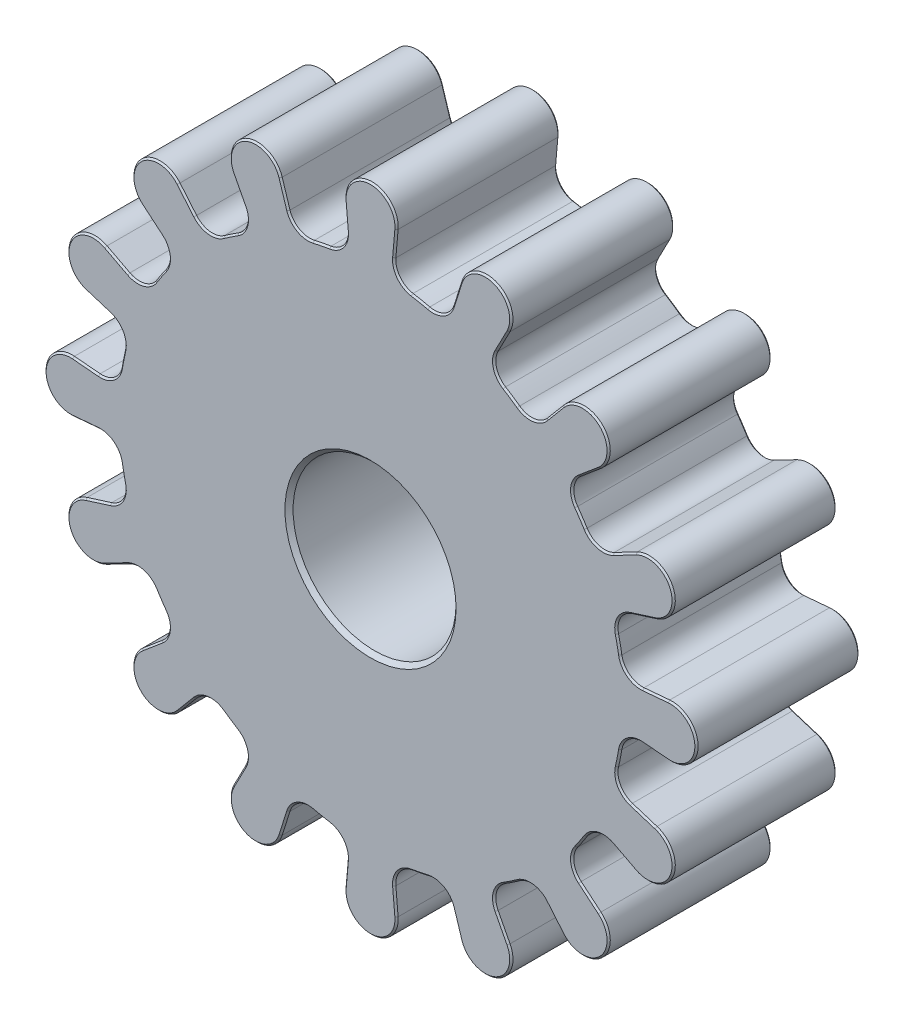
SolidWorks part; units mm, degrees
ref_plane "Спереди" through (0, 0, 0) normal (0, 0, 1) x (1, 0, 0)
ref_plane "Сверху" through (0, 0, 0) normal (0, 1, 0) x (1, 0, 0)
ref_plane "Справа" through (0, 0, 0) normal (1, 0, 0) x (0, 0, -1)
sketch "Эскиз1" plane through (0, 0, 0) normal (0, 0, 1) x (1, 0, 0)
  line L0 (-1.4563, 16.6835) -> (-1.5939, 18.2609)
  line L1 (1.4563, 16.6835) -> (1.5939, 18.2609)
  line L2 (5.0391, 15.9708) -> (5.5155, 17.4808)
  line L3 (7.7299, 14.8562) -> (8.4607, 16.2609)
  line L4 (10.7673, 12.8267) -> (11.7853, 14.0395)
  line L5 (12.8267, 10.7673) -> (14.0395, 11.7853)
  line L6 (14.8562, 7.7299) -> (16.2609, 8.4607)
  line L7 (15.9708, 5.0391) -> (17.4808, 5.5155)
  line L8 (16.6835, 1.4563) -> (18.2609, 1.5939)
  line L9 (16.6835, -1.4563) -> (18.2609, -1.5939)
  line L10 (15.9708, -5.0391) -> (17.4808, -5.5155)
  line L11 (14.8562, -7.7299) -> (16.2609, -8.4607)
  line L12 (12.8267, -10.7673) -> (14.0395, -11.7853)
  line L13 (10.7673, -12.8267) -> (11.7853, -14.0395)
  line L14 (7.7299, -14.8562) -> (8.4607, -16.2609)
  line L15 (5.0391, -15.9708) -> (5.5155, -17.4808)
  line L16 (1.4563, -16.6835) -> (1.5939, -18.2609)
  line L17 (-1.4563, -16.6835) -> (-1.5939, -18.2609)
  line L18 (-5.0391, -15.9708) -> (-5.5155, -17.4808)
  line L19 (-7.7299, -14.8562) -> (-8.4607, -16.2609)
  line L20 (-10.7673, -12.8267) -> (-11.7853, -14.0395)
  line L21 (-12.8267, -10.7673) -> (-14.0395, -11.7853)
  line L22 (-14.8562, -7.7299) -> (-16.2609, -8.4607)
  line L23 (-15.9708, -5.0391) -> (-17.4808, -5.5155)
  line L24 (-16.6835, -1.4563) -> (-18.2609, -1.5939)
  line L25 (-16.6835, 1.4563) -> (-18.2609, 1.5939)
  line L26 (-15.9708, 5.0391) -> (-17.4808, 5.5155)
  line L27 (-14.8562, 7.7299) -> (-16.2609, 8.4607)
  line L28 (-12.8267, 10.7673) -> (-14.0395, 11.7853)
  line L29 (-10.7673, 12.8267) -> (-11.7853, 14.0395)
  line L30 (-7.7299, 14.8562) -> (-8.4607, 16.2609)
  line L31 (-5.0391, 15.9708) -> (-5.5155, 17.4808)
  circle A0 centre (0, 0) radius 18.4 construction
  arc A1 (1.5939, 18.2609) -> (-1.5939, 18.2609) centre (0, 18.4) ccw
  arc A2 (-8.1868, 13.191) -> (-9.0539, 12.6116) centre (0, 0) ccw
  arc A3 (8.4607, 16.2609) -> (5.5155, 17.4808) centre (7.0414, 16.9994) ccw
  arc A4 (14.0395, 11.7853) -> (11.7853, 14.0395) centre (13.0108, 13.0108) ccw
  arc A5 (17.4808, 5.5155) -> (16.2609, 8.4607) centre (16.9994, 7.0414) ccw
  arc A6 (18.2609, -1.5939) -> (18.2609, 1.5939) centre (18.4, 0) ccw
  arc A7 (16.2609, -8.4607) -> (17.4808, -5.5155) centre (16.9994, -7.0414) ccw
  arc A8 (11.7853, -14.0395) -> (14.0395, -11.7853) centre (13.0108, -13.0108) ccw
  arc A9 (5.5155, -17.4808) -> (8.4607, -16.2609) centre (7.0414, -16.9994) ccw
  arc A10 (-1.5939, -18.2609) -> (1.5939, -18.2609) centre (0, -18.4) ccw
  arc A11 (-8.4607, -16.2609) -> (-5.5155, -17.4808) centre (-7.0414, -16.9994) ccw
  arc A12 (-14.0395, -11.7853) -> (-11.7853, -14.0395) centre (-13.0108, -13.0108) ccw
  arc A13 (-17.4808, -5.5155) -> (-16.2609, -8.4607) centre (-16.9994, -7.0414) ccw
  arc A14 (-18.2609, 1.5939) -> (-18.2609, -1.5939) centre (-18.4, 0) ccw
  arc A15 (-16.2609, 8.4607) -> (-17.4808, 5.5155) centre (-16.9994, 7.0414) ccw
  arc A16 (-11.7853, 14.0395) -> (-14.0395, 11.7853) centre (-13.0108, 13.0108) ccw
  arc A17 (-5.5155, 17.4808) -> (-8.4607, 16.2609) centre (-7.0414, 16.9994) ccw
  arc A18 (-2.5157, 15.3198) -> (-3.5385, 15.1164) centre (0, 0) ccw
  arc A19 (3.5385, 15.1164) -> (2.5157, 15.3198) centre (0, 0) ccw
  arc A20 (9.0539, 12.6116) -> (8.1868, 13.191) centre (0, 0) ccw
  arc A21 (-12.6116, 9.0539) -> (-13.191, 8.1868) centre (0, 0) ccw
  arc A22 (13.191, 8.1868) -> (12.6116, 9.0539) centre (0, 0) ccw
  arc A23 (15.3198, 2.5157) -> (15.1164, 3.5385) centre (0, 0) ccw
  arc A24 (15.1164, -3.5385) -> (15.3198, -2.5157) centre (0, 0) ccw
  arc A25 (12.6116, -9.0539) -> (13.191, -8.1868) centre (0, 0) ccw
  arc A26 (8.1868, -13.191) -> (9.0539, -12.6116) centre (0, 0) ccw
  arc A27 (2.5157, -15.3198) -> (3.5385, -15.1164) centre (0, 0) ccw
  arc A28 (-3.5385, -15.1164) -> (-2.5157, -15.3198) centre (0, 0) ccw
  arc A29 (-9.0539, -12.6116) -> (-8.1868, -13.191) centre (0, 0) ccw
  arc A30 (-13.191, -8.1868) -> (-12.6116, -9.0539) centre (0, 0) ccw
  arc A31 (-15.3198, -2.5157) -> (-15.1164, -3.5385) centre (0, 0) ccw
  arc A32 (-15.1164, 3.5385) -> (-15.3198, 2.5157) centre (0, 0) ccw
  circle A33 centre (0, 0) radius 5
  arc A34 (16.6835, -1.4563) -> (15.3198, -2.5157) centre (16.573, -2.7214) ccw
  arc A35 (15.9708, -5.0391) -> (15.1164, -3.5385) centre (16.3529, -3.8279) cw
  arc A36 (14.8562, -7.7299) -> (13.191, -8.1868) centre (14.27, -8.8565) ccw
  arc A37 (12.8267, -10.7673) -> (12.6116, -9.0539) centre (13.6433, -9.7946) cw
  arc A38 (10.7673, -12.8267) -> (9.0539, -12.6116) centre (9.7946, -13.6433) ccw
  arc A39 (7.7299, -14.8562) -> (8.1868, -13.191) centre (8.8565, -14.27) cw
  arc A40 (5.0391, -15.9708) -> (3.5385, -15.1164) centre (3.8279, -16.3529) ccw
  arc A41 (1.4563, -16.6835) -> (2.5157, -15.3198) centre (2.7214, -16.573) cw
  arc A42 (-1.4563, -16.6835) -> (-2.5157, -15.3198) centre (-2.7214, -16.573) ccw
  arc A43 (-5.0391, -15.9708) -> (-3.5385, -15.1164) centre (-3.8279, -16.3529) cw
  arc A44 (-7.7299, -14.8562) -> (-8.1868, -13.191) centre (-8.8565, -14.27) ccw
  arc A45 (-10.7673, -12.8267) -> (-9.0539, -12.6116) centre (-9.7946, -13.6433) cw
  arc A46 (-12.8267, -10.7673) -> (-12.6116, -9.0539) centre (-13.6433, -9.7946) ccw
  arc A47 (-14.8562, -7.7299) -> (-13.191, -8.1868) centre (-14.27, -8.8565) cw
  arc A48 (-15.9708, -5.0391) -> (-15.1164, -3.5385) centre (-16.3529, -3.8279) ccw
  arc A49 (-16.6835, -1.4563) -> (-15.3198, -2.5157) centre (-16.573, -2.7214) cw
  arc A50 (-16.6835, 1.4563) -> (-15.3198, 2.5157) centre (-16.573, 2.7214) ccw
  arc A51 (-15.9708, 5.0391) -> (-15.1164, 3.5385) centre (-16.3529, 3.8279) cw
  arc A52 (-14.8562, 7.7299) -> (-13.191, 8.1868) centre (-14.27, 8.8565) ccw
  arc A53 (-12.8267, 10.7673) -> (-12.6116, 9.0539) centre (-13.6433, 9.7946) cw
  arc A54 (16.6835, 1.4563) -> (15.3198, 2.5157) centre (16.573, 2.7214) cw
  arc A55 (15.9708, 5.0391) -> (15.1164, 3.5385) centre (16.3529, 3.8279) ccw
  arc A56 (14.8562, 7.7299) -> (13.191, 8.1868) centre (14.27, 8.8565) cw
  arc A57 (12.8267, 10.7673) -> (12.6116, 9.0539) centre (13.6433, 9.7946) ccw
  arc A58 (-10.7673, 12.8267) -> (-9.0539, 12.6116) centre (-9.7946, 13.6433) ccw
  arc A59 (-7.7299, 14.8562) -> (-8.1868, 13.191) centre (-8.8565, 14.27) cw
  arc A60 (-5.0391, 15.9708) -> (-3.5385, 15.1164) centre (-3.8279, 16.3529) ccw
  arc A61 (-1.4563, 16.6835) -> (-2.5157, 15.3198) centre (-2.7214, 16.573) cw
  arc A62 (10.7673, 12.8267) -> (9.0539, 12.6116) centre (9.7946, 13.6433) cw
  arc A63 (7.7299, 14.8562) -> (8.1868, 13.191) centre (8.8565, 14.27) ccw
  arc A64 (5.0391, 15.9708) -> (3.5385, 15.1164) centre (3.8279, 16.3529) cw
  arc A65 (1.4563, 16.6835) -> (2.5157, 15.3198) centre (2.7214, 16.573) ccw
  point P86 (15.4662, -1.35)
  point P89 (14.8055, -4.6714)
  point P92 (13.7723, -7.1659)
  point P95 (11.8908, -9.9817)
  point P98 (9.9817, -11.8908)
  point P101 (7.1659, -13.7723)
  point P104 (4.6714, -14.8055)
  point P107 (1.35, -15.4662)
  point P110 (-1.35, -15.4662)
  point P113 (-4.6714, -14.8055)
  point P116 (-7.1659, -13.7723)
  point P119 (-9.9817, -11.8908)
  point P122 (-11.8908, -9.9817)
  point P125 (-13.7723, -7.1659)
  point P128 (-14.8055, -4.6714)
  point P131 (-15.4662, -1.35)
  point P134 (-15.4662, 1.35)
  point P137 (-14.8055, 4.6714)
  point P140 (-13.7723, 7.1659)
  point P143 (-11.8908, 9.9817)
  point P146 (15.4662, 1.35)
  point P149 (14.8055, 4.6714)
  point P152 (13.7723, 7.1659)
  point P163 (-1.35, 15.4662)
  point P166 (9.9817, 11.8908)
  point P171 (4.6714, 14.8055)
  point P176 (-56.8951, -9.6977)
  dimension "D1" = 36.8
  dimension "D2" = 3.2
  dimension "D3" = 31.05
  dimension "D5" = 10
  dimension "D6" = 1.27
  dimension "D4" = 16
extrude "Бобышка-Вытянуть1" add sketch "Эскиз1" along normal blind 10
chamfer "Фаска1" distance 0.25 angle 45 2 edges at (5, 0, 0) (5, 0, 10)
chamfer "Фаска2" distance 0.1 angle 45 192 edges at (-7.6537, -18.4776, 0) (-5.2773, -16.7258, 0) (-8.0953, -15.5586, 0) (-4.4563, -15.2493, 0) (-7.6318, -13.934, 0) (-3.0288, -15.2267, 0) (-8.6252, -12.9086, 0) (-1.7185, -15.7939, 0) (-9.9528, -12.3832, 0) (-1.5251, -17.4722, 0) (-11.2763, -13.4331, 0) (0, -20, 0) (-14.1421, -14.1421, 0) (1.5251, -17.4722, 0) (-13.4331, -11.2763, 0) (1.7185, -15.7939, 0) (-12.3832, -9.9528, 0) (3.0288, -15.2267, 0) (-12.9086, -8.6252, 0) (4.4563, -15.2493, 0) (-13.934, -7.6318, 0) (5.2773, -16.7258, 0) (-15.5586, -8.0953, 0) (7.6537, -18.4776, 0) (-18.4776, -7.6537, 0) (8.0953, -15.5586, 0) (-16.7258, -5.2773, 0) (7.6318, -13.934, 0) (-15.2493, -4.4563, 0) (8.6252, -12.9086, 0) (-15.2267, -3.0288, 0) (9.9528, -12.3832, 0) (-15.7939, -1.7185, 0) (11.2763, -13.4331, 0) (-17.4722, -1.5251, 0) (14.1421, -14.1421, 0) (-20, 0, 0) (13.4331, -11.2763, 0) (-17.4722, 1.5251, 0) (12.3832, -9.9528, 0) (-15.7939, 1.7185, 0) (12.9086, -8.6252, 0) (-15.2267, 3.0288, 0) (13.934, -7.6318, 0) (-15.2493, 4.4563, 0) (15.5586, -8.0953, 0) (-16.7258, 5.2773, 0) (18.4776, -7.6537, 0) (-18.4776, 7.6537, 0) (16.7258, -5.2773, 0) (-15.5586, 8.0953, 0) (15.2493, -4.4563, 0) (-13.934, 7.6318, 0) (15.2267, -3.0288, 0) (-12.9086, 8.6252, 0) (15.7939, -1.7185, 0) (-12.3832, 9.9528, 0) (17.4722, -1.5251, 0) (-13.4331, 11.2763, 0) (20, 0, 0) (-14.1421, 14.1421, 0) (17.4722, 1.5251, 0) (-11.2763, 13.4331, 0) (15.7939, 1.7185, 0) (-9.9528, 12.3832, 0) (15.2267, 3.0288, 0) (-8.6252, 12.9086, 0) (15.2493, 4.4563, 0) (-7.6318, 13.934, 0) (16.7258, 5.2773, 0) (-8.0953, 15.5586, 0) (18.4776, 7.6537, 0) (-7.6537, 18.4776, 0) (15.5586, 8.0953, 0) (-5.2773, 16.7258, 0) (13.934, 7.6318, 0) (-4.4563, 15.2493, 0) (12.9086, 8.6252, 0) (-3.0288, 15.2267, 0) (12.3832, 9.9528, 0) (-1.7185, 15.7939, 0) (13.4331, 11.2763, 0) (-1.5251, 17.4722, 0) (14.1421, 14.1421, 0) (0, 20, 0) (11.2763, 13.4331, 0) (1.5251, 17.4722, 0) (9.9528, 12.3832, 0) (1.7185, 15.7939, 0) (8.6252, 12.9086, 0) (3.0288, 15.2267, 0) (7.6318, 13.934, 0) (4.4563, 15.2493, 0) (8.0953, 15.5586, 0) (5.2773, 16.7258, 0) (7.6537, 18.4776, 0) (-7.6537, -18.4776, 10) (-5.2773, -16.7258, 10) (-8.0953, -15.5586, 10) (-4.4563, -15.2493, 10) (-7.6318, -13.934, 10) (-3.0288, -15.2267, 10) (-8.6252, -12.9086, 10) (-1.7185, -15.7939, 10) (-9.9528, -12.3832, 10) (-1.5251, -17.4722, 10) (-11.2763, -13.4331, 10) (0, -20, 10) (-14.1421, -14.1421, 10) (1.5251, -17.4722, 10) (-13.4331, -11.2763, 10) (1.7185, -15.7939, 10) (-12.3832, -9.9528, 10) (3.0288, -15.2267, 10) (-12.9086, -8.6252, 10) (4.4563, -15.2493, 10) (-13.934, -7.6318, 10) (5.2773, -16.7258, 10) (-15.5586, -8.0953, 10) (7.6537, -18.4776, 10) (-18.4776, -7.6537, 10) (8.0953, -15.5586, 10) (-16.7258, -5.2773, 10) (7.6318, -13.934, 10) (-15.2493, -4.4563, 10) (8.6252, -12.9086, 10) (-15.2267, -3.0288, 10) (9.9528, -12.3832, 10) (-15.7939, -1.7185, 10) (11.2763, -13.4331, 10) (-17.4722, -1.5251, 10) (14.1421, -14.1421, 10) (-20, 0, 10) (13.4331, -11.2763, 10) (-17.4722, 1.5251, 10) (12.3832, -9.9528, 10) (-15.7939, 1.7185, 10) (12.9086, -8.6252, 10) (-15.2267, 3.0288, 10) (13.934, -7.6318, 10) (-15.2493, 4.4563, 10) (15.5586, -8.0953, 10) (-16.7258, 5.2773, 10) (18.4776, -7.6537, 10) (-18.4776, 7.6537, 10) (16.7258, -5.2773, 10) (-15.5586, 8.0953, 10) (15.2493, -4.4563, 10) (-13.934, 7.6318, 10) (15.2267, -3.0288, 10) (-12.9086, 8.6252, 10) (15.7939, -1.7185, 10) (-12.3832, 9.9528, 10) (17.4722, -1.5251, 10) (-13.4331, 11.2763, 10) (20, 0, 10) (-14.1421, 14.1421, 10) (17.4722, 1.5251, 10) (-11.2763, 13.4331, 10) (15.7939, 1.7185, 10) (-9.9528, 12.3832, 10) (15.2267, 3.0288, 10) (-8.6252, 12.9086, 10) (15.2493, 4.4563, 10) (-7.6318, 13.934, 10) (16.7258, 5.2773, 10) (-8.0953, 15.5586, 10) (18.4776, 7.6537, 10) (-7.6537, 18.4776, 10) (15.5586, 8.0953, 10) (-5.2773, 16.7258, 10) (13.934, 7.6318, 10) (-4.4563, 15.2493, 10) (12.9086, 8.6252, 10) (-3.0288, 15.2267, 10) (12.3832, 9.9528, 10) (-1.7185, 15.7939, 10) (13.4331, 11.2763, 10) (-1.5251, 17.4722, 10) (14.1421, 14.1421, 10) (0, 20, 10) (11.2763, 13.4331, 10) (1.5251, 17.4722, 10) (9.9528, 12.3832, 10) (1.7185, 15.7939, 10) (8.6252, 12.9086, 10) (3.0288, 15.2267, 10) (7.6318, 13.934, 10) (4.4563, 15.2493, 10) (8.0953, 15.5586, 10) (5.2773, 16.7258, 10) (7.6537, 18.4776, 10)
